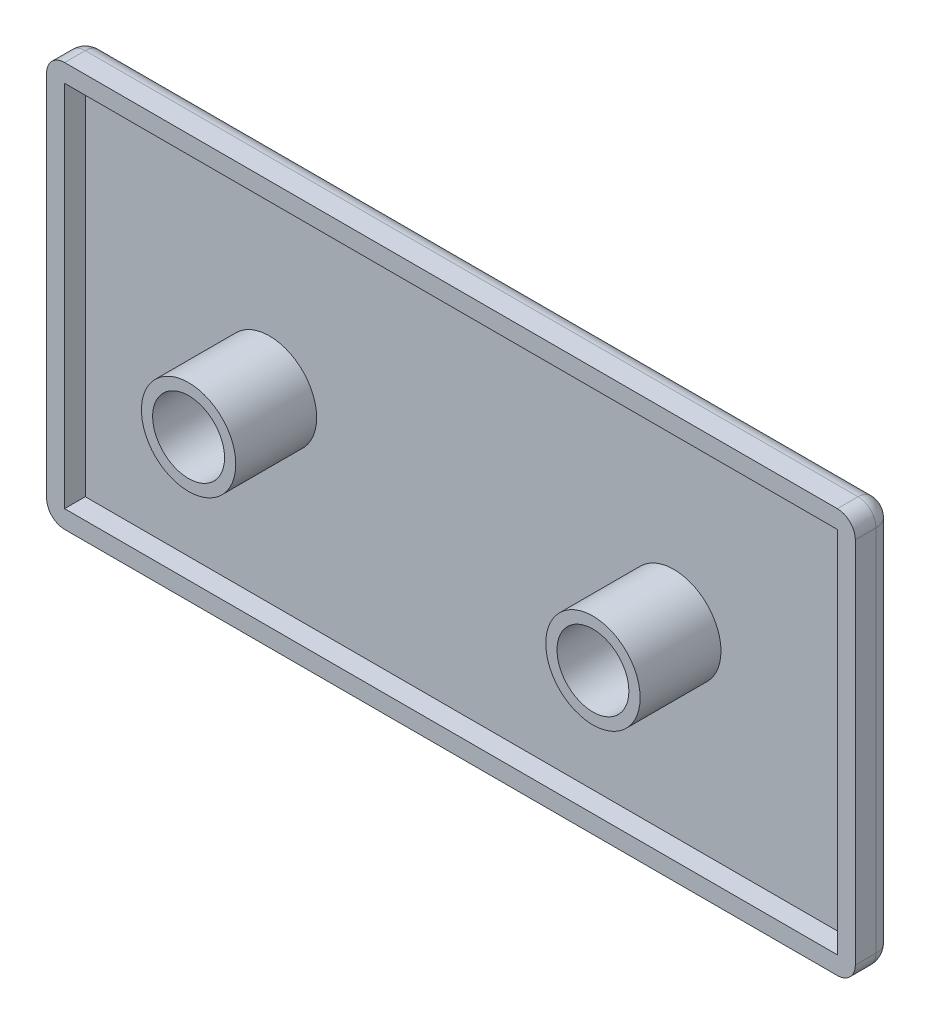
SolidWorks part; units mm, degrees
ref_plane "前视基准面" through (0, 0, 0) normal (0, 0, 1) x (1, 0, 0)
ref_plane "上视基准面" through (0, 0, 0) normal (0, 1, 0) x (1, 0, 0)
ref_plane "右视基准面" through (0, 0, 0) normal (1, 0, 0) x (0, 0, -1)
sketch "草图1" plane through (0, 0, 0) normal (0, 0, 1) x (1, 0, 0)
  line L1 (-45, 22.5) -> (45, 22.5)
  line L2 (-45, 22.5) -> (-45, -22.5)
  line L3 (-45, -22.5) -> (45, -22.5)
  line L4 (45, 22.5) -> (45, -22.5)
  dimension "D1" = 90
  dimension "D2" = 45
  dimension "D3" = 22.5
extrude "凸台-拉伸1" add sketch "草图1" along normal mid plane 4.3
fillet "圆角1" radius 2 8 edges at (-45, 22.5, 0) (-45, 0, -2.15) (-45, -22.5, 0) (0, -22.5, -2.15) (45, -22.5, 0) (0, 22.5, -2.15) (45, 0, -2.15) (45, 22.5, 0)
shell "抽壳1" thickness 2
sketch "草图2" plane through (0, 0, -0.15) normal (0, 0, 1) x (1, 0, 0)
  line L0 (-45, 20.5) -> (-45, -20.5) construction
  circle A0 centre (-22.5, 0) radius 5.25
  circle A1 centre (22.5, 0) radius 5.25
  circle A2 centre (-22.5, 0) radius 4
  circle A3 centre (22.5, 0) radius 4
  dimension "D1" = 10.5
  dimension "D2" = 10.5
  dimension "D3" = 45
  dimension "D4" = 22.5
  dimension "D5" = 8
  dimension "D6" = 8
extrude "凸台-拉伸2" add sketch "草图2" along normal blind 9
